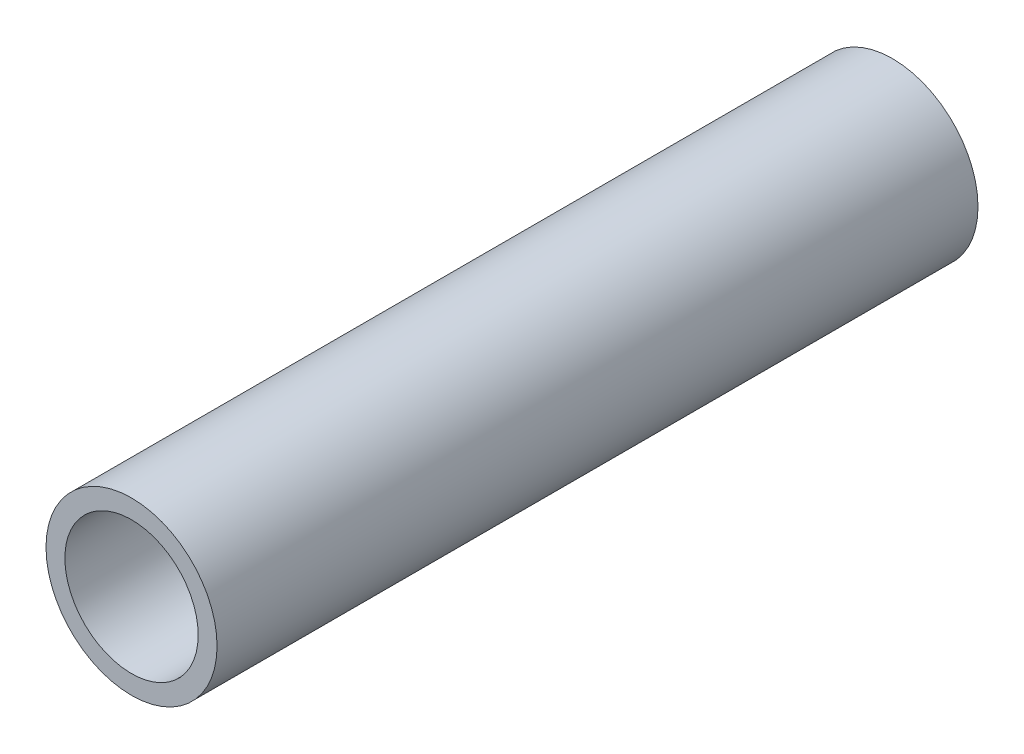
SolidWorks part; units mm, degrees
ref_plane "Front Plane" through (0, 0, 0) normal (0, 0, 1) x (1, 0, 0)
ref_plane "Top Plane" through (0, 0, 0) normal (0, 1, 0) x (1, 0, 0)
ref_plane "Right Plane" through (0, 0, 0) normal (1, 0, 0) x (0, 0, -1)
sketch "Sketch1" plane through (0, 0, 0) normal (0, 0, 1) x (1, 0, 0)
  circle A0 centre (0, 0) radius 7.1374
  dimension "D1" = 14.2748
extrude "Extrude-Thin1" add sketch "Sketch1" along normal blind 63.5 thin
